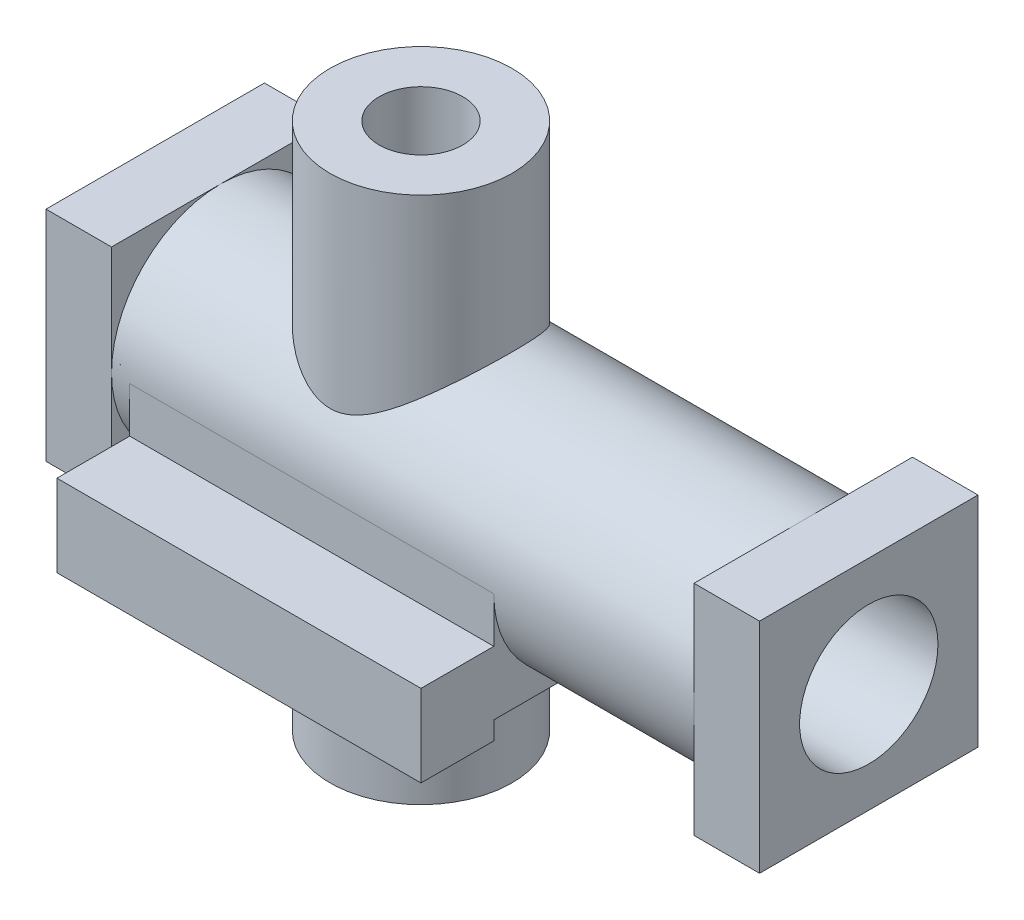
SolidWorks part; units mm, degrees
ref_plane "Plane1" through (0, 0, 0) normal (0, 0, 1) x (1, 0, 0)
ref_plane "Plane2" through (0, 0, 0) normal (0, 1, 0) x (1, 0, 0)
ref_plane "Plane3" through (0, 0, 0) normal (1, 0, 0) x (0, 0, -1)
sketch "Sketch1" plane through (0, 0, 0) normal (1, 0, 0) x (0, 0, -1)
  circle A0 centre (0, 0) radius 76.2
  dimension "D1" = 152.4
extrude "HorizBody" add sketch "Sketch1" along normal blind 304.8 and the other way blind 177.8
sketch "Sketch2" plane through (0, 0, 0) normal (0, 1, 0) x (1, 0, 0)
  circle A0 centre (0, 0) radius 63.5
  dimension "D1" = 127
extrude "VertBody" add sketch "Sketch2" along normal mid plane 355.6
sketch "Sketch3" plane through (304.8, 0, 0) normal (1, 0, 0) x (0, 0, -1)
  line L0 (-76.2, 76.2) -> (76.2, 76.2)
  line L1 (-76.2, 76.2) -> (-76.2, -76.2)
  line L2 (76.2, -76.2) -> (-76.2, -76.2)
  line L3 (76.2, -76.2) -> (76.2, 76.2)
  line L4 (0, 0) -> (138.3557, 0) construction
  line L5 (0, 0) -> (0, -125.803) construction
  circle A0 centre (0, 0) radius 76.2 construction
extrude "RightFlange" add sketch "Sketch3" against normal blind 38.1
sketch "Sketch4" plane through (-177.8, 0, 0) normal (-1, 0, 0) x (0, 0, 1)
  line L4 (76.2, -76.2) -> (-76.2, -76.2)
  line L5 (-76.2, -76.2) -> (-76.2, 76.2)
  line L6 (-76.2, 76.2) -> (76.2, 76.2)
  line L7 (76.2, 76.2) -> (76.2, -76.2)
  line L8 (76.2, -76.2) -> (-76.2, -76.2)
  line L9 (-76.2, -76.2) -> (-76.2, 76.2)
  line L10 (-76.2, 76.2) -> (76.2, 76.2)
  line L11 (76.2, 76.2) -> (76.2, -76.2)
  dimension "D1" = 0
extrude "LeftFlange" add sketch "Sketch4" against normal blind 38.1
sketch "Sketch5" plane through (0, 0, 0) normal (1, 0, 0) x (0, 0, -1)
  line L0 (0, 0) -> (0, -165.0407) construction
  line L1 (0, -42.1211) -> (0, -177.8) construction
  line L2 (-76.2, -76.2) -> (76.2, -76.2)
  line L3 (76.2, -76.2) -> (-76.2, -76.2) construction
  line L4 (76.2, -76.2) -> (76.2, -82.55)
  line L5 (-76.2, -76.2) -> (-76.2, -82.55)
  line L6 (76.2, -82.55) -> (127, -82.55)
  line L7 (-76.2, -82.55) -> (-127, -82.55)
  line L8 (127, -82.55) -> (127, -39.751)
  line L9 (-127, -82.55) -> (-127, -39.751)
  line L10 (127, -39.751) -> (-127, -39.751)
  point P11 (0, -76.2)
  point P18 (0, -39.751)
  dimension "D1" = 254
  dimension "D2" = 42.799
  dimension "D3" = 82.55
extrude "BaseFlange" add sketch "Sketch5" along normal mid plane 254
sketch "Sketch6" plane through (0, 0, 0) normal (1, 0, 0) x (0, 0, -1)
  circle A0 centre (0, 0) radius 48.26
  dimension "D1" = 96.52
extrude "HorizBore" cut sketch "Sketch6" against normal through all and the other way through all
sketch "Sketch7" plane through (0, 0, 0) normal (0, 1, 0) x (1, 0, 0)
  circle A0 centre (0, 0) radius 29.21
  dimension "D1" = 58.42
extrude "VertBore" cut sketch "Sketch7" against normal through all and the other way through all
sketch "Sketch19" plane through (0, 177.8, 0) normal (0, 1, 0) x (-1, 0, 0)
  circle A0 centre (0, 0) radius 29.21 construction
  circle A1 centre (0, 0) radius 63.5
  circle A2 centre (0, 0) radius 63.5
  circle A3 centre (0, 0) radius 29.21
  dimension "D1" = 0
extrude "ThickenTop" add sketch "Sketch19" along normal blind 6.35
sketch "Sketch20" plane through (0, -177.8, 0) normal (0, -1, 0) x (1, 0, 0)
  circle A0 centre (0, 0) radius 29.21 construction
  circle A1 centre (0, 0) radius 63.5
  circle A2 centre (0, 0) radius 63.5
  circle A3 centre (0, 0) radius 29.21
  dimension "D1" = 0
extrude "ThickenBottom" add sketch "Sketch20" along normal blind 6.35
sketch "Sketch22" plane through (304.8, 0, 0) normal (1, 0, 0) x (0, 0, -1)
  line L4 (-76.2, -76.2) -> (76.2, -76.2)
  line L5 (76.2, -76.2) -> (76.2, 76.2)
  line L6 (76.2, 76.2) -> (-76.2, 76.2)
  line L7 (-76.2, 76.2) -> (-76.2, -76.2)
  line L8 (-76.2, -76.2) -> (76.2, -76.2)
  line L9 (76.2, -76.2) -> (76.2, 76.2)
  line L10 (76.2, 76.2) -> (-76.2, 76.2)
  line L11 (-76.2, 76.2) -> (-76.2, -76.2)
  circle A1 centre (0, 0) radius 48.26
  circle A2 centre (0, 0) radius 48.26
  dimension "D1" = 0
  dimension "D2" = 0
extrude "ThickenRight" add sketch "Sketch22" along normal blind 7.62
sketch "Sketch23" plane through (-177.8, 0, 0) normal (-1, 0, 0) x (0, 0, 1)
  line L4 (76.2, 76.2) -> (-76.2, 76.2)
  line L5 (-76.2, 76.2) -> (-76.2, -76.2)
  line L6 (-76.2, -76.2) -> (76.2, -76.2)
  line L7 (76.2, -76.2) -> (76.2, 76.2)
  line L8 (76.2, 76.2) -> (-76.2, 76.2)
  line L9 (-76.2, 76.2) -> (-76.2, -76.2)
  line L10 (-76.2, -76.2) -> (76.2, -76.2)
  line L11 (76.2, -76.2) -> (76.2, 76.2)
  circle A1 centre (0, 0) radius 48.26
  circle A2 centre (0, 0) radius 48.26
  dimension "D1" = 0
  dimension "D2" = 0
extrude "ThickenLeft" add sketch "Sketch23" along normal blind 7.62
sketch "Sketch25" plane through (0, -39.751, 0) normal (0, 1, 0) x (-1, 0, 0)
  line L4 (-127, 127) -> (-127, 65.01)
  line L5 (-127, 65.01) -> (127, 65.01)
  line L6 (127, 65.01) -> (127, 127)
  line L7 (127, 127) -> (-127, 127)
  line L8 (-127, 127) -> (-127, 65.01)
  line L9 (-127, 65.01) -> (127, 65.01)
  line L10 (127, 65.01) -> (127, 127)
  line L11 (127, 127) -> (-127, 127)
  line L12 (127, -127) -> (127, -65.01)
  line L13 (127, -65.01) -> (-127, -65.01)
  line L14 (-127, -65.01) -> (-127, -127)
  line L15 (-127, -127) -> (127, -127)
  line L16 (127, -127) -> (127, -65.01)
  line L17 (127, -65.01) -> (-127, -65.01)
  line L18 (-127, -65.01) -> (-127, -127)
  line L19 (-127, -127) -> (127, -127)
  dimension "D1" = 0
  dimension "D2" = 0
extrude "ThickenBaseTop" add sketch "Sketch25" along normal blind 8.001
sketch "Sketch26" plane through (0, -82.55, 0) normal (0, -1, 0) x (1, 0, 0)
  line L4 (-127, 76.2) -> (127, 76.2)
  line L5 (127, 76.2) -> (127, 127)
  line L6 (127, 127) -> (-127, 127)
  line L7 (-127, 127) -> (-127, 76.2)
  line L8 (-127, 76.2) -> (127, 76.2)
  line L9 (127, 76.2) -> (127, 127)
  line L10 (127, 127) -> (-127, 127)
  line L11 (-127, 127) -> (-127, 76.2)
  line L12 (-127, -127) -> (127, -127)
  line L13 (127, -127) -> (127, -76.2)
  line L14 (127, -76.2) -> (-127, -76.2)
  line L15 (-127, -76.2) -> (-127, -127)
  line L16 (-127, -127) -> (127, -127)
  line L17 (127, -127) -> (127, -76.2)
  line L18 (127, -76.2) -> (-127, -76.2)
  line L19 (-127, -76.2) -> (-127, -127)
  dimension "D1" = 0
  dimension "D2" = 0
extrude "ThickenBaseBottom" add sketch "Sketch26" along normal blind 6.35
sketch "Sketch27" plane through (0, -31.75, 0) normal (0, 1, 0) x (-1, 0, 0)
  line L0 (-266.7, -76.2) -> (139.7, -76.2) construction
  line L1 (-127, -76.2) -> (127, -76.2)
  line L2 (-127, -69.2703) -> (127, -69.2703) construction
  line L3 (-127, -69.2703) -> (127, -69.2703)
  line L4 (-127, -69.2703) -> (-127, -127) construction
  line L5 (127, -127) -> (127, -69.2703) construction
  line L6 (-127, -69.2703) -> (-127, -76.2)
  line L7 (127, -76.2) -> (127, -69.2703)
extrude "RemoveBackUndercut" add sketch "Sketch27" along normal up to next
mirror "RemoveFrontUndercut" about plane through (0, 0, 0) normal (0, 0, 1) of "RemoveBackUndercut"
